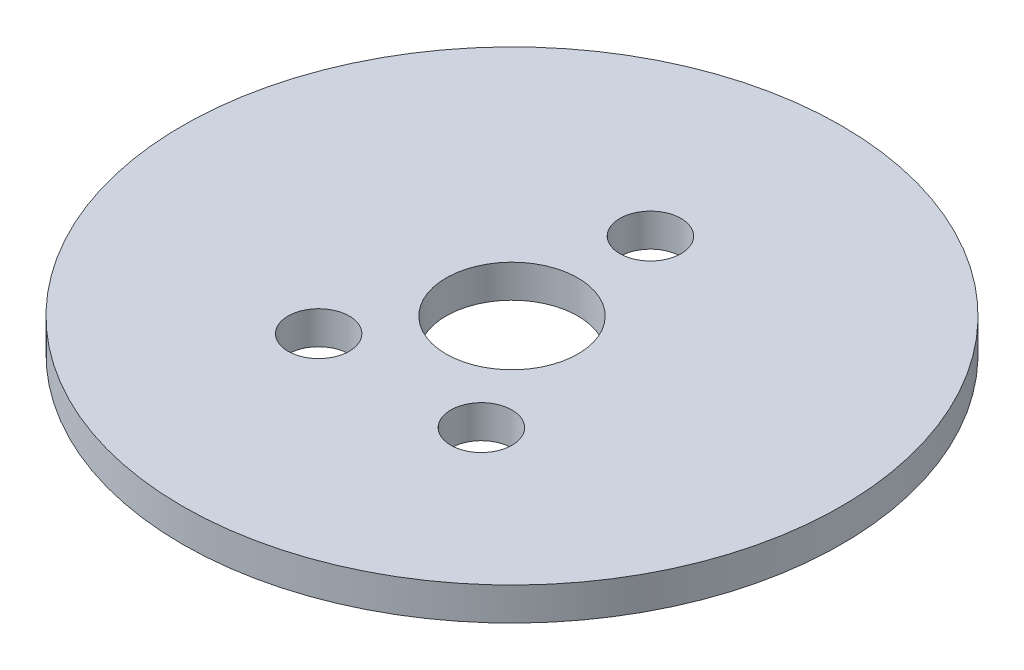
SolidWorks part; units mm, degrees
ref_plane "Front Plane" through (0, 0, 0) normal (0, 0, 1) x (1, 0, 0)
ref_plane "Top Plane" through (0, 0, 0) normal (0, 1, 0) x (1, 0, 0)
ref_plane "Right Plane" through (0, 0, 0) normal (1, 0, 0) x (0, 0, -1)
sketch "Sketch1" plane through (0, 0, 0) normal (0, 1, 0) x (1, 0, 0)
  circle A0 centre (0.5622, -11.5196) radius 3.175
  circle A1 centre (0.5622, -11.5196) radius 6.6675 construction
  circle A2 centre (0.5622, -11.5196) radius 15.875
  circle A3 centre (0.5622, -4.8521) radius 1.4732
  circle A4 centre (6.9033, -9.4592) radius 1.4732 construction
  circle A5 centre (4.4812, -16.9137) radius 1.4732
  circle A6 centre (-3.3569, -16.9137) radius 1.4732
  circle A7 centre (-5.779, -9.4592) radius 1.4732 construction
  point P7 (0, 0)
  point P8 (0, 0)
  point P17 (0.5622, -11.5196)
  dimension "D1" = 6.35
  dimension "D2" = 13.335
  dimension "D3" = 31.75
  dimension "D4" = 2.9464
  dimension "D5" = 5
extrude "Boss-Extrude1" add sketch "Sketch1" along normal blind 1.5875
